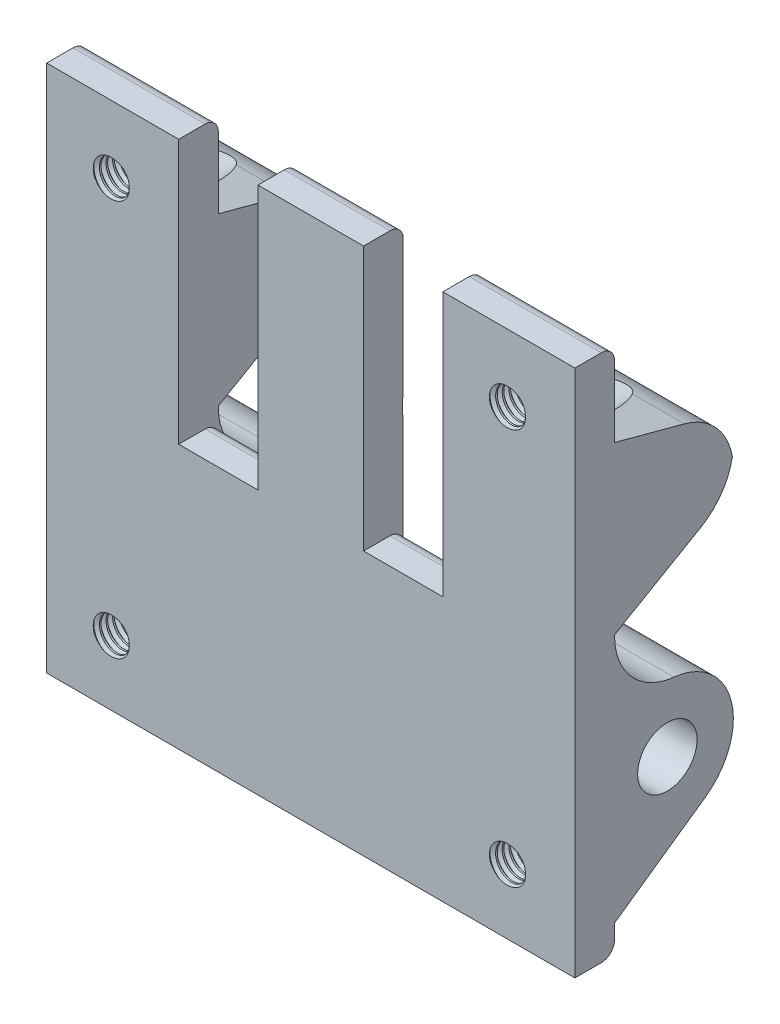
SolidWorks part; units mm, degrees
ref_plane "Front Plane" through (0, 0, 0) normal (0, 0, 1) x (1, 0, 0)
ref_plane "Top Plane" through (0, 0, 0) normal (0, 1, 0) x (1, 0, 0)
ref_plane "Right Plane" through (0, 0, 0) normal (1, 0, 0) x (0, 0, -1)
sketch "Sketch2" plane through (0, 0, 0) normal (1, 0, 0) x (0, 0, -1)
  line L3 (7, 16.0053) -> (3, 16.0053)
  line L4 (3, 16.0053) -> (3, 21.0053)
  line L6 (12, 26.2015) -> (12, 31.2015)
  line L7 (12, 31.2015) -> (3, 33.613)
  line L8 (0, 16.0053) -> (0, 0)
  line L9 (0, 0) -> (9.8679, 6.9096) construction
  line L10 (12, 11.0053) -> (12, 26.2015) construction
  line L11 (3, 21.0053) -> (12, 26.2015)
  line L15 (0, 16.0053) -> (0, 40)
  line L16 (0, 40) -> (3, 40)
  line L17 (3, 40) -> (3, 33.613)
  line L18 (0, 0) -> (3, 0)
  line L19 (3, 0) -> (3, 2.1006)
  line L20 (3, 2.1006) -> (9.8679, 6.9096)
  circle A1 centre (7, 11.0053) radius 2.25
  arc A3 (7, 16.0053) -> (9.8679, 6.9096) centre (7, 11.0053) cw
  point P2 (0, 0)
  point P3 (0, 0)
  dimension "D1" = 120
  dimension "D4" = 4.5
  dimension "D5" = 5
  dimension "D2" = 4
  dimension "D3" = 75
  dimension "D7" = 3
  dimension "D8" = 55
  dimension "D9" = 5
  dimension "D10" = 5
  dimension "D11" = 40
extrude "Boss-Extrude2" add sketch "Sketch2" along normal mid plane 40
sketch "Sketch3" plane through (0, 0, 0) normal (0, 1, 0) x (1, 0, 0)
  line L0 (0, 12) -> (0, 0) construction
  line L1 (20, 12) -> (-20, 12) construction
  line L2 (20, 0) -> (-20, 0) construction
  line L3 (20, 3) -> (-20, 3) construction
  line L4 (-10, 3) -> (10, 3)
  line L5 (-10, 3) -> (-10, 12)
  line L6 (-10, 12) -> (10, 12)
  line L7 (10, 3) -> (10, 12)
  line L8 (0, 12) -> (0, 3) construction
  line L9 (-10, 7.5) -> (10, 7.5) construction
  point P6 (0, 7.5)
  dimension "D1" = 20
extrude "Hinge Cutout" cut sketch "Sketch3" along normal through all both and the other way through all
hole_wizard "Tap Drill for M3x0.5 Tap1" positions "Sketch8" profile "Sketch7" hole size "M3x0.5" standard "ANSI Metric"
sketch "Sketch8" plane through (0, 0, -3) normal (0, 0, -1) x (-1, 0, 0)
  line L3 (0, 20) -> (-20, 20) construction
  line L4 (-20, 21.0053) -> (-20, 26.2015) construction
  line L8 (0, 0) -> (0, 40) construction
  line L10 (-20, 40) -> (20, 40) construction
  line L12 (-20, 0) -> (20, 0) construction
  point P0 (-15, 35)
  point P19 (-15, 5)
  point P41 (0, 20)
  point P44 (15, 5)
  point P45 (15, 35)
  dimension "D1" = 30
  dimension "D2" = 30
sketch "Sketch7" plane through (15, 35, -3) normal (1, 0, 0) x (0, 1, 0)
  line L0 (0, 0) -> (0, 3)
  line L1 (0, 3) -> (1.25, 3)
  line L2 (1.25, 3) -> (1.25, 0)
  line L5 (1.25, 0) -> (0, 0)
  line L11 (0, -6.35) -> (0, 107.95) construction
  dimension "Thru Hole Dia." = 2.5
  dimension "Thru Hole Depth" = 3
fillet "Fillet1" radius 5 6 edges at (-15, 16.0053, -3) (15, 16.0053, -3) (-15, 26.2015, -12) (15, 26.2015, -12) (-15, 31.2015, -12) (15, 31.2015, -12)
sketch "Sketch15" plane through (0, 0, 0) normal (1, 0, 0) x (0, 0, -1)
  line L0 (0, 40) -> (0, 0) construction
  line L1 (7, 11.0053) -> (9.1752, 28.8734) construction
  line L2 (2.75, 28.4964) -> (7, 11.0053) construction
  line L3 (3, 40) -> (0, 40) construction
  line L4 (1.5, 28.4964) -> (1.5, 40) construction
  line L6 (10.4252, 28.8734) -> (10.4252, 40) construction
  arc A0 (2.75, 28.4964) -> (9.1752, 28.8734) centre (7, 11.0053) cw construction
  arc A1 (9.3262, 30.1143) -> (2.4549, 29.7111) centre (7, 11.0053) ccw
  arc A2 (3.0451, 27.2817) -> (9.0241, 27.6326) centre (7, 11.0053) cw
  arc A3 (9.3262, 30.1143) -> (9.0241, 27.6326) centre (9.1752, 28.8734) cw
  arc A4 (2.4549, 29.7111) -> (3.0451, 27.2817) centre (2.75, 28.4964) ccw
  dimension "D3" = 18
  dimension "D4" = 2.5
  dimension "D1" = 1.5
  dimension "D2" = 1.5
extrude "Arc Slot" [suppressed] cut sketch "Sketch15" along normal through all both and the other way through all
sketch "Sketch14" plane through (0, 0, -3) normal (0, 0, -1) x (-1, 0, 0)
  line L0 (0, 40) -> (0, 0) construction
  line L1 (-20, 40) -> (20, 40) construction
  line L2 (-20, 0) -> (20, 0) construction
  line L3 (-10, 28.2265) -> (-10, 32.1945) construction
  line L4 (-10, 40) -> (-4, 40)
  line L5 (-10, 40) -> (-10, 20)
  line L6 (-10, 20) -> (-4, 20)
  line L7 (-4, 40) -> (-4, 20)
  line L8 (10, 20) -> (4, 20)
  line L9 (4, 40) -> (4, 20)
  line L10 (10, 40) -> (4, 40)
  line L11 (10, 40) -> (10, 20)
  dimension "D1" = 6
  dimension "D2" = 20
extrude "Hinge Teeth cutout" cut sketch "Sketch14" against normal through all
sketch "Sketch16" plane through (0, 0, 0) normal (1, 0, 0) x (0, 0, -1)
  line L1 (0, 40) -> (3, 40)
  line L2 (0, 40) -> (0, 0)
  line L3 (0, 0) -> (3, 0)
  line L4 (3, 40) -> (3, 0)
extrude "Fill in for above" add sketch "Sketch16" along normal mid plane 8
sketch "Sketch13" plane through (0, 0, -3) normal (0, 0, -1) x (-1, 0, 0)
  line L0 (0, 40) -> (0, 0) construction
  line L2 (-20, 0) -> (20, 0) construction
  line L3 (-10, 40) -> (10, 40) construction
  line L6 (-4, 40) -> (4, 40) construction
  line L7 (-20, 40) -> (-10, 40) construction
  line L8 (-20, 0) -> (20, 0) construction
  circle A0 centre (0, 28) radius 2.413
  circle A1 centre (0, 28) radius 3.302
  dimension "D1" = 6.604
  dimension "D2" = 4.826
  dimension "D3" = 28
extrude "Spring Cutout" cut sketch "Sketch13" against normal blind 2
sketch "Sketch17" plane through (0, 0, -3) normal (0, 0, -1) x (-1, 0, 0)
  circle A0 centre (-15, 35) radius 3
  circle A1 centre (-15, 35) radius 1.25 construction
  circle A2 centre (-15, 5) radius 3
  circle A3 centre (15, 5) radius 3
  circle A4 centre (15, 35) radius 3
  circle A5 centre (15, 35) radius 1.25 construction
  circle A6 centre (-15, 5) radius 1.25 construction
  circle A7 centre (15, 5) radius 1.25 construction
  dimension "D1" = 6
extrude "Cut-Extrude10" cut sketch "Sketch17" along normal through all
fillet "Fillet2" radius 1 2 edges at (0, 31.302, -3) (0, 30.413, -3)
fillet "Fillet3" radius 1 6 edges at (0, 40, -3) (-15, 40, -3) (7, 20, -3) (-7, 20, -3) (15, 40, -3) (0, 0, -3)
thread "Thread1" pitch 0.5 start angle 0, offset 0, length 10, pitch 0.5, diameter 2.5
ref_plane "Plane1" through (16.25, 5, -3) normal (0, -1, 0) x (1, 0, 0)
sketch "Thread Profile1" plane through (16.25, 5, -3) normal (0, -1, 0) x (1, 0, 0)
  line L0 (0, 0) -> (0, 0.5) construction
  line L1 (0, 0) -> (0.2706, 0.1562)
  line L2 (0.2706, 0.1562) -> (0.2706, 0.2187)
  line L3 (0.2706, 0.2187) -> (0, 0.375)
  line L4 (0.2706, 0.1875) -> (0, 0.1875) construction
  line L11 (0, 0) -> (0, 0.375)
  point P2 (0, 0)
  dimension "Pitch" = 0.5
  dimension "Profile_Angle" = 60
  dimension "Profile_Land" = 0.0625
  dimension "Profile_Height" = 0.2706
thread "Thread2" pitch 0.5 start angle 0, offset 0, length 10, pitch 0.5, diameter 2.5
ref_plane "Plane2" through (-13.75, 5, -3) normal (0, -1, 0) x (1, 0, 0)
sketch "Thread Profile2" plane through (-13.75, 5, -3) normal (0, -1, 0) x (1, 0, 0)
  line L0 (0, 0) -> (0, 0.5) construction
  line L1 (0, 0) -> (0.2706, 0.1562)
  line L2 (0.2706, 0.1562) -> (0.2706, 0.2187)
  line L3 (0.2706, 0.2187) -> (0, 0.375)
  line L4 (0.2706, 0.1875) -> (0, 0.1875) construction
  line L11 (0, 0) -> (0, 0.375)
  point P2 (0, 0)
  dimension "Pitch" = 0.5
  dimension "Profile_Angle" = 60
  dimension "Profile_Land" = 0.0625
  dimension "Profile_Height" = 0.2706
thread "Thread3" pitch 0.5 start angle 0, offset 0, length 10, pitch 0.5, diameter 2.5
ref_plane "Plane3" through (-13.75, 35, -3) normal (0, -1, 0) x (1, 0, 0)
sketch "Thread Profile3" plane through (-13.75, 35, -3) normal (0, -1, 0) x (1, 0, 0)
  line L0 (0, 0) -> (0, 0.5) construction
  line L1 (0, 0) -> (0.2706, 0.1562)
  line L2 (0.2706, 0.1562) -> (0.2706, 0.2187)
  line L3 (0.2706, 0.2187) -> (0, 0.375)
  line L4 (0.2706, 0.1875) -> (0, 0.1875) construction
  line L11 (0, 0) -> (0, 0.375)
  point P2 (0, 0)
  dimension "Pitch" = 0.5
  dimension "Profile_Angle" = 60
  dimension "Profile_Land" = 0.0625
  dimension "Profile_Height" = 0.2706
thread "Thread4" pitch 0.5 start angle 0, offset 0, length 10, pitch 0.5, diameter 2.5
ref_plane "Plane4" through (16.25, 35, -3) normal (0, -1, 0) x (1, 0, 0)
sketch "Thread Profile4" plane through (16.25, 35, -3) normal (0, -1, 0) x (1, 0, 0)
  line L0 (0, 0) -> (0, 0.5) construction
  line L1 (0, 0) -> (0.2706, 0.1562)
  line L2 (0.2706, 0.1562) -> (0.2706, 0.2187)
  line L3 (0.2706, 0.2187) -> (0, 0.375)
  line L4 (0.2706, 0.1875) -> (0, 0.1875) construction
  line L11 (0, 0) -> (0, 0.375)
  point P2 (0, 0)
  dimension "Pitch" = 0.5
  dimension "Profile_Angle" = 60
  dimension "Profile_Land" = 0.0625
  dimension "Profile_Height" = 0.2706
